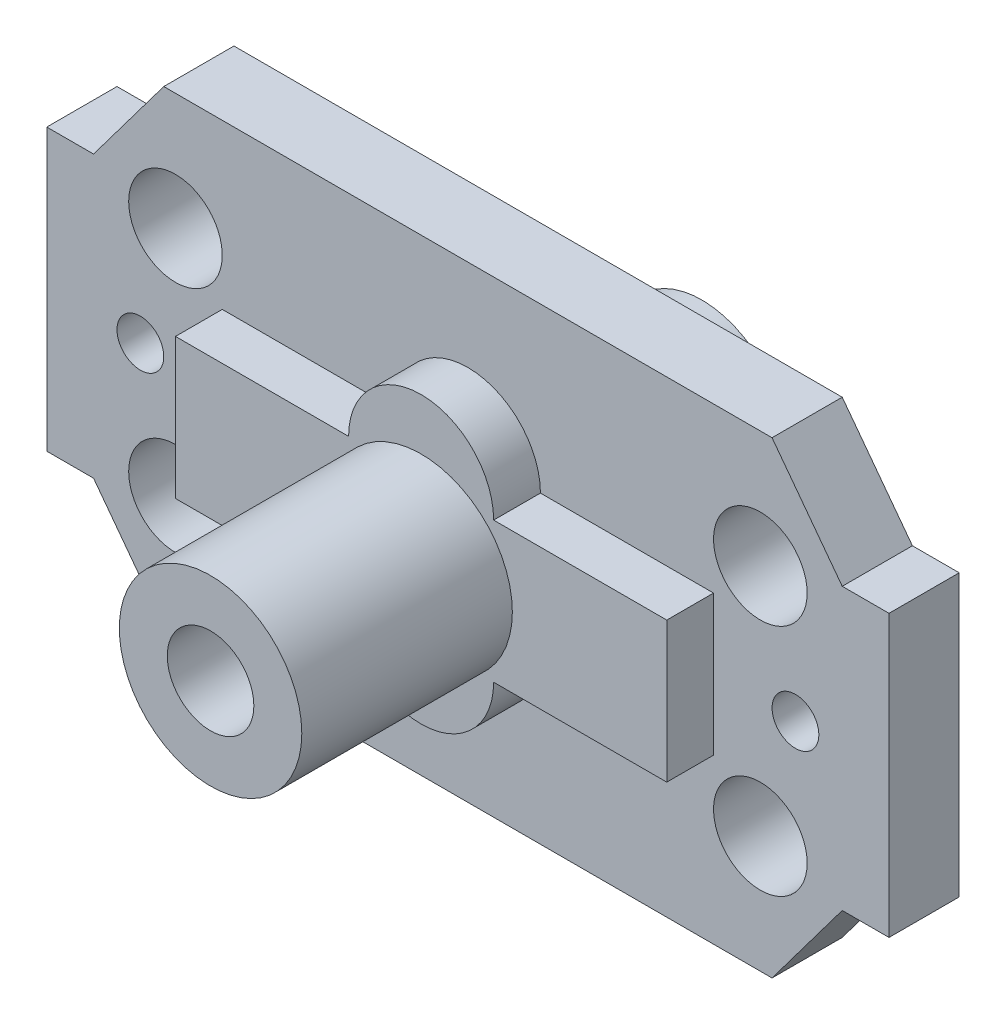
SolidWorks part; units mm, degrees
ref_plane "Face" through (0, 0, 0) normal (0, 0, 1) x (1, 0, 0)
ref_plane "Dessus" through (0, 0, 0) normal (0, 1, 0) x (1, 0, 0)
ref_plane "Droite" through (0, 0, 0) normal (1, 0, 0) x (0, 0, -1)
sketch "Esquisse1" plane through (0, 0, 0) normal (0, 0, 1) x (1, 0, 0)
  line L0 (0, 0) -> (0, 5)
  line L1 (0, 5) -> (6.5, 5)
  line L2 (6.5, 5) -> (8, 3)
  line L3 (8, 3) -> (9, 3)
  line L4 (0, 0) -> (9, 0)
  line L5 (9, 0) -> (9, 3)
  dimension "D1" = 3
  dimension "D2" = 9
  dimension "D3" = 6.5
  dimension "D4" = 8
  dimension "D5" = 5
extrude "plaque" add sketch "Esquisse1" along normal blind 1.5
sketch "Esquisse2" plane through (0, 0, 1.5) normal (0, 0, 1) x (1, 0, 0)
  line L1 (0, 0) -> (5.25, 0)
  line L2 (0, 0) -> (0, -0.05)
  line L3 (1.55, 1.5) -> (5.25, 1.5)
  line L4 (5.25, 0) -> (5.25, 1.5)
  line L5 (0, 5) -> (0, 0) construction
  arc A1 (1.55, 1.5) -> (0, -0.05) centre (0, 1.5) ccw
  dimension "D5" = 3.1
  dimension "D3" = 5.25
  dimension "D4" = 1.5
extrude "centrage superieur" add sketch "Esquisse2" along normal blind 1
sketch "Esquisse6" plane through (0, 0, 1.5) normal (0, 0, 1) x (1, 0, 0)
  circle A0 centre (0, 0) radius 1.95
  dimension "D1" = 3.9
extrude "guidage superieur" add sketch "Esquisse6" along normal blind 5.5
sketch "Esquisse8" plane through (0, 0, 0) normal (0, 0, -1) x (-1, 0, 0)
  line L0 (0, 3.05) -> (0, 0) construction
  line L1 (0, 0) -> (-9, 0) construction
  circle A0 centre (-3.5, 2) radius 0.5
  dimension "D1" = 1
  dimension "D2" = 3.5
  dimension "D3" = 2
extrude "centrage inférieur" add sketch "Esquisse8" along normal blind 1
fillet "Congé centrage inférieur" radius 0.5 1 edges at (3, 2, -1)
sketch "Esquisse7" plane through (0, 0, 0) normal (0, 0, -1) x (-1, 0, 0)
  circle A0 centre (0, 0) radius 1.8
  dimension "D1" = 3.6
extrude "guidage inferieur" add sketch "Esquisse7" along normal blind 3.5
sketch "Esquisse3" plane through (0, 0, 1.5) normal (0, 0, 1) x (1, 0, 0)
  line L0 (5.25, 0) -> (9, 0) construction
  line L1 (0, 5) -> (0, 3.05) construction
  line L2 (5.25, 1.5) -> (1.55, 1.5) construction
  circle A0 centre (7, 0) radius 0.5
  circle A1 centre (6.25, 2.5) radius 1
  circle A2 centre (0, 0) radius 0.9251
  dimension "D1" = 1
  dimension "D3" = 2
  dimension "D2" = 7
  dimension "D4" = 6.25
extrude "perçage" cut sketch "Esquisse3" against normal through all and the other way through all
mirror "Symétrie1"
mirror "Symétrie2" about plane through (0, 0, 1.5) normal (1, 0, 0)
